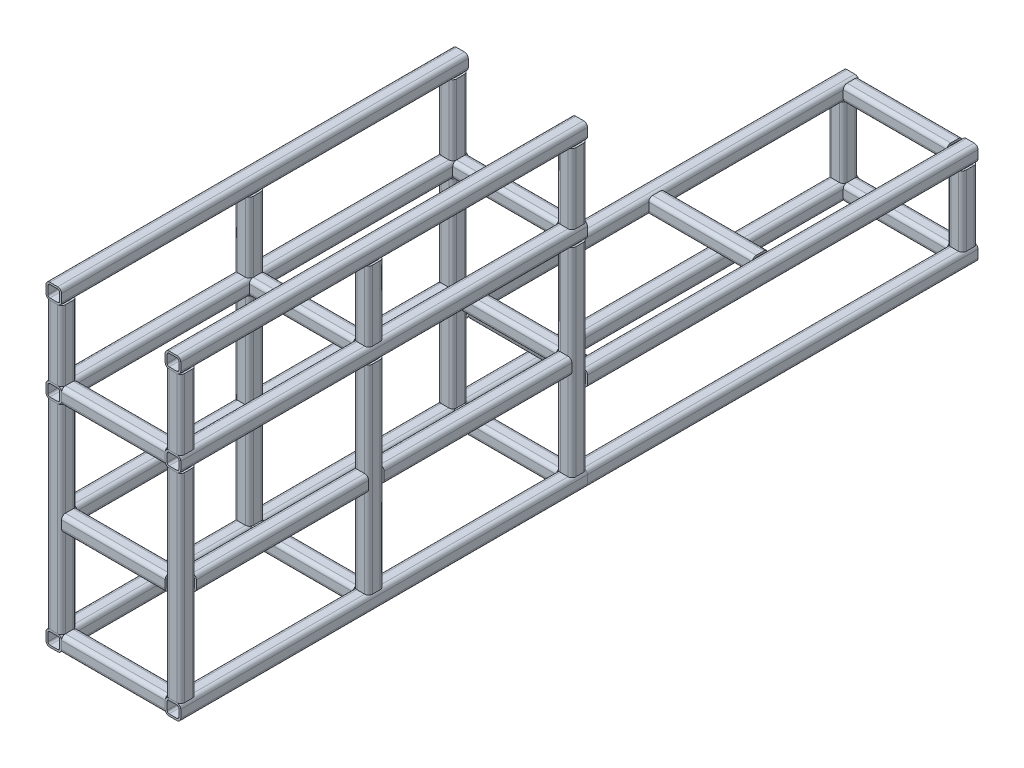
SolidWorks part; units mm, degrees
ref_plane "Front Plane" through (0, 0, 0) normal (0, 0, 1) x (1, 0, 0)
ref_plane "Top Plane" through (0, 0, 0) normal (0, 1, 0) x (1, 0, 0)
ref_plane "Right Plane" through (0, 0, 0) normal (1, 0, 0) x (0, 0, -1)
sketch3d "3DSketch1"
  line L0 (-51, 0, 0) -> (389, 0, 0)
  line L1 (389, 0, 0) -> (389, 701.3682, 0)
  line L2 (-51, 0, 0) -> (-51, 701.3682, 0)
  line L3 (-51, 701.3682, 0) -> (389, 701.3682, 0)
  line L4 (389, 0, 0) -> (389, 0, -1328)
  line L5 (389, 0, -1328) -> (389, 701.3682, -1328)
  line L6 (389, 701.3682, -1328) -> (389, 701.3682, 0)
  line L7 (-51, 0, 0) -> (-51, 0, -1328)
  line L8 (-51, 0, -1328) -> (-51, 701.3682, -1328)
  line L9 (-51, 701.3682, -1328) -> (-51, 701.3682, 0)
  line L10 (-51, 0, -1328) -> (389, 0, -1328)
  line L11 (-51, 701.3682, -1328) -> (389, 701.3682, -1328)
  line L12 (389, 0, -664) -> (-51, 0, -664)
  line L13 (-51, 0, -664) -> (-51, 701.3682, -664)
  line L14 (-51, 701.3682, -664) -> (389, 701.3682, -664)
  line L15 (389, 701.3682, -664) -> (389, 0, -664)
  line L16 (428.8617, 0, -3417.8617) -> (428.8617, 0, -2898.1383)
  line L17 (428.8617, 0, -3417.8617) -> (-90.8617, 0, -3417.8617)
  line L18 (-90.8617, 0, -3417.8617) -> (-90.8617, 0, -2898.1383)
  line L19 (428.8617, 0, -2898.1383) -> (169, 0, -2898.1383)
  line L20 (428.8617, 0, -3417.8617) -> (428.8617, 558.7, -3417.8617)
  line L21 (428.8617, 558.7, -3417.8617) -> (-90.8617, 558.7, -3417.8617)
  line L22 (-90.8617, 558.7, -3417.8617) -> (-90.8617, 0, -3417.8617)
  line L23 (428.8617, 0, -2898.1383) -> (428.8617, 558.7, -2898.1383)
  line L24 (428.8617, 558.7, -2898.1383) -> (-90.8617, 558.7, -2898.1383)
  line L25 (-90.8617, 558.7, -2898.1383) -> (-90.8617, 0, -2898.1383)
  line L26 (-90.8617, 558.7, -2898.1383) -> (-90.8617, 558.7, -3417.8617)
  line L27 (428.8617, 558.7, -2898.1383) -> (428.8617, 558.7, -3417.8617)
  line L28 (169, 0, 0) -> (169, 0, -2898.1383) construction
  line L29 (389, 340.9341, 0) -> (389, 340.9341, -664)
  line L30 (389, 340.9341, -664) -> (389, 340.9341, -1328)
  line L31 (389, 340.9341, -1328) -> (-51, 340.9341, -1328)
  line L32 (-51, 340.9341, -1328) -> (-51, 340.9341, -664)
  line L33 (-51, 340.9341, -664) -> (-51, 340.9341, 0)
  line L34 (-51, 340.9341, 0) -> (389, 340.9341, 0)
  line L35 (389, 280.9341, -1328) -> (389, 280.9341, -2898.1383)
  line L36 (-51, 280.9341, -1328) -> (-51, 280.9341, -2898.1383)
  line L37 (-51, 280.9341, -2898.1383) -> (389, 280.9341, -2898.1383)
  line L38 (-90.8617, 280.9341, -2898.1383) -> (-51, 280.9341, -2898.1383)
  line L39 (389, 280.9341, -2898.1383) -> (428.8617, 280.9341, -2898.1383)
  line L40 (-51, 280.9341, -1328) -> (389, 280.9341, -1328)
  line L41 (169, 0, -2898.1383) -> (169, 280.9341, -2898.1383) construction
  line L42 (169, 280.9341, -2898.1383) -> (169, 280.9341, -3158) construction
  line L43 (169, 280.9341, -3158) -> (169, 0, -3158) construction
  line L44 (169, 0, -2898.1383) -> (-90.8617, 0, -2898.1383)
  line L45 (169, 0, -2898.1383) -> (169, 0, -3417.8617) construction
  line L46 (169, 280.9341, -1328) -> (169, 0, -1328) construction
  line L47 (389, 0, -1328) -> (389, 0, -2898.1383)
  line L48 (-51, 0, -1328) -> (-51, 0, -2898.1383)
  line L49 (-90.8617, 280.9341, -2898.1383) -> (-90.8617, 280.9341, -3417.8617)
  line L50 (-90.8617, 280.9341, -3417.8617) -> (428.8617, 280.9341, -3417.8617)
  line L51 (428.8617, 280.9341, -3417.8617) -> (428.8617, 280.9341, -2898.1383)
  line L52 (428.8617, 558.7, -2898.1383) -> (-90.8617, 558.7, -3417.8617) construction
  line L53 (389, 280.9341, -2603) -> (-51, 280.9341, -2603)
  line L54 (389, 280.9341, -1968.0018) -> (-51, 280.9341, -1968.0018)
  line L55 (19, 558.7, -2898.1383) -> (19, 558.7, -3417.8617)
  line L56 (319, 558.7, -2898.1383) -> (319, 558.7, -3417.8617)
  line L57 (169, 558.7, -2898.1383) -> (169, 558.7, -3417.8617) construction
  line L58 (-51, 280.9341, -2603) -> (-51, 0, -2603)
  line L59 (389, 280.9341, -2603) -> (389, 0, -2603)
  line L60 (-51, 0, -2603) -> (389, 0, -2603)
  line L61 (389, 701.3682, 0) -> (389, 981.3682, 0)
  line L62 (389, 981.3682, 0) -> (389, 981.3682, -1328)
  line L63 (389, 981.3682, -1328) -> (389, 701.3682, -1328)
  line L64 (389, 701.3682, -664) -> (389, 981.3682, -664)
  line L65 (-51, 701.3682, 0) -> (-51, 981.3682, 0)
  line L66 (-51, 981.3682, 0) -> (-51, 981.3682, -1328)
  line L67 (-51, 981.3682, -1328) -> (-51, 701.3682, -1328)
  line L68 (-51, 701.3682, -664) -> (-51, 981.3682, -664)
  circle A1 centre (169, 545.8682, -3158) radius 120 construction
  point P50 (169, 425.8682, -3158)
  dimension "D10" = 300
  dimension "D1" = 1328
  dimension "D2" = 360.4341
  dimension "D8" = 1275
  dimension "D3" = 440
  dimension "D4" = 735
  dimension "D5" = 340.9341
  dimension "D6" = 60
  dimension "D7" = 277.7659
  dimension "D9" = 640
  dimension "D11" = 150
  dimension "D12" = 280
other "Structural Member1"
ref_plane "Plane2" through (-51, 701.3682, -1328) normal (0, 0, 1) x (1, 0, 0)
sketch "Sketch1" plane through (-51, 701.3682, -1328) normal (0, 0, 1) x (1, 0, 0)
  line L0 (-12.7, -19.05) -> (12.7, -19.05)
  line L1 (-19.05, -12.7) -> (-19.05, 12.7)
  line L2 (12.7, 19.05) -> (-12.7, 19.05)
  line L3 (19.05, 12.7) -> (19.05, -12.7)
  line L4 (-12.7, -25.4) -> (12.7, -25.4)
  line L5 (-25.4, -12.7) -> (-25.4, 12.7)
  line L6 (12.7, 25.4) -> (-12.7, 25.4)
  line L7 (25.4, 12.7) -> (25.4, -12.7)
  line L8 (0, 0) -> (19.05, 0) construction
  line L9 (0, 0) -> (0, 19.05) construction
  arc A0 (25.4, 12.7) -> (12.7, 25.4) centre (12.7, 12.7) ccw
  arc A1 (12.7, -25.4) -> (25.4, -12.7) centre (12.7, -12.7) ccw
  arc A2 (-25.4, -12.7) -> (-12.7, -25.4) centre (-12.7, -12.7) ccw
  arc A3 (-12.7, 25.4) -> (-25.4, 12.7) centre (-12.7, 12.7) ccw
  arc A4 (-12.7, 19.05) -> (-19.05, 12.7) centre (-12.7, 12.7) ccw
  arc A5 (19.05, 12.7) -> (12.7, 19.05) centre (12.7, 12.7) ccw
  arc A6 (12.7, -19.05) -> (19.05, -12.7) centre (12.7, -12.7) ccw
  arc A7 (-19.05, -12.7) -> (-12.7, -19.05) centre (-12.7, -12.7) ccw
  point P3 (0, 25.4)
  point P4 (25.4, 0)
  point P5 (0, -25.4)
  point P6 (-25.4, 0)
  point P7 (-25.4, 25.4)
  point P8 (-25.4, -25.4)
  point P33 (0, 0)
  point P35 (25.4, -25.4)
  point P36 (25.4, 25.4)
  point P37 (0, 0)
  dimension "D1" = 12.7
  dimension "Thickness" = 6.35
  dimension "V_leg" = 50.8
other "Trim/Extend1"
equation "\"D11@3DSketch1\" = \"D10@3DSketch1\"/2"
